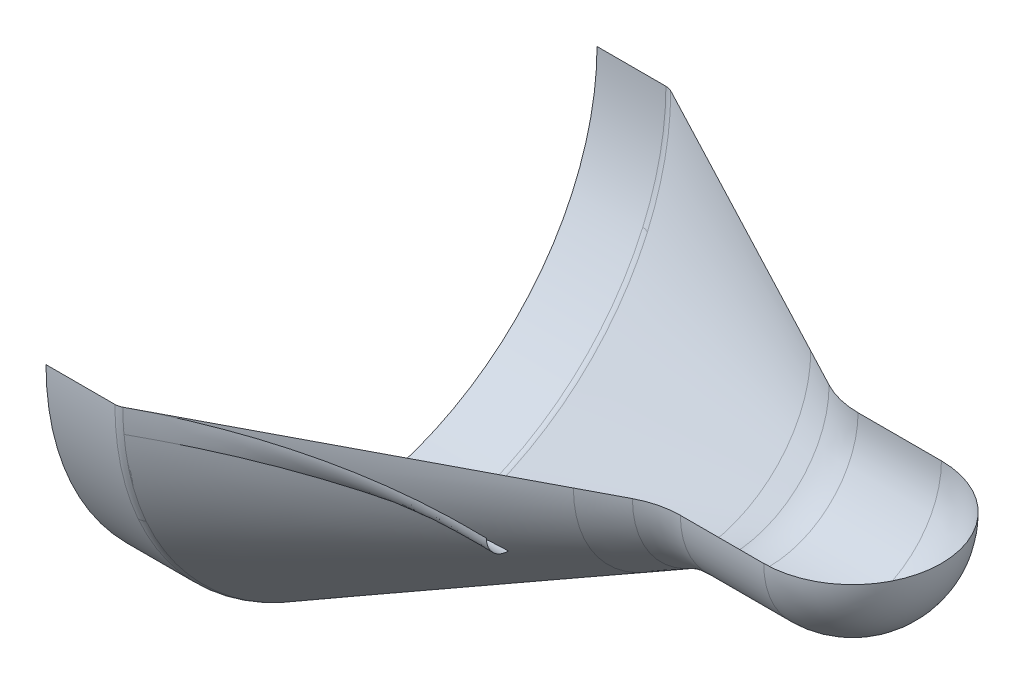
SolidWorks part; units mm, degrees
ref_plane "Vorne" through (0, 0, 0) normal (0, 0, 1) x (1, 0, 0)
ref_plane "Oben" through (0, 0, 0) normal (0, 1, 0) x (1, 0, 0)
ref_plane "Rechts" through (0, 0, 0) normal (1, 0, 0) x (0, 0, -1)
sketch "Skizze1" plane through (0, 0, 0) normal (0, 1, 0) x (1, 0, 0)
  line L0 (0, 0) -> (770.7263, 0) construction
  line L1 (0, 200) -> (50, 200)
  line L2 (54.6536, 198.8512) -> (297.0781, 71.3929)
  line L3 (2, 198) -> (50, 198) construction
  line L4 (0, 198) -> (50, 198) construction
  line L5 (385.5, 64.5) -> (325, 64.5)
  line L6 (53.7229, 197.081) -> (296.1474, 69.6226) construction
  line L7 (385.5, 62.5) -> (325, 62.5) construction
  line L8 (0, 200) -> (0, 198) construction
  line L9 (448, 0) -> (450, 0) construction
  line L10 (385.5, 64.5) -> (385.5, 62.5) construction
  line L12 (0, 200) -> (0, 196.253) construction
  line L19 (2, 198) -> (2, 196.253) construction
  arc A0 (50, 200) -> (54.6536, 198.8512) centre (50, 190) cw
  arc A1 (50, 198) -> (53.7229, 197.081) centre (50, 190) cw construction
  arc A2 (325, 62.5) -> (296.1474, 69.6226) centre (325, 124.5) cw construction
  arc A3 (385.5, 62.5) -> (448, 0) centre (385.5, 0) cw construction
  arc A4 (325, 64.5) -> (297.0781, 71.3929) centre (325, 124.5) cw
  arc A8 (385.5, 64.5) -> (450, 0) centre (385.5, 0) cw
  point P14 (87.3818, 188.4588)
  point P15 (510.3654, -55.7509)
  dimension "D2" = 10
  dimension "D4" = 2
  dimension "D5" = 60
  dimension "D7" = 64.5
  dimension "D3" = 400
  dimension "D6" = 50
  dimension "D8" = 325
  dimension "D13" = 450
surface "Oberfläche-Rotation1" sketch "Skizze1" parameters "D1"=180
ref_plane "Ebene1" through (100, 0, 0) normal (1, 0, 0) x (0, 0, -1)
sketch "Skizze9" plane through (0, 0, 0) normal (0, 0, 1) x (1, 0, 0)
  line L0 (50, -80.3054) -> (54.6536, -80.3054)
  line L1 (50, -200) -> (50, 0) construction
  line L2 (54.6536, -198.8512) -> (54.6536, 0) construction
ref_plane "Ebene2" through (269, 0, 0) normal (1, 0, 0) x (0, 0, -1)
sketch "Skizze11" plane through (269, 0, 0) normal (1, 0, 0) x (0, 0, -1)
  line L0 (-49.3016, -16) -> (-133.3016, -16) construction
  line L2 (-49.3016, -16) -> (-133.3016, -16)
  arc A0 (-149.3016, 0) -> (-133.3016, -16) centre (-133.3016, 0) ccw construction
  arc A2 (-149.3016, 0) -> (-133.3016, -16) centre (-133.3016, 0) ccw
surface "Oberfläche-Ausformung2"
surface "Oberfläche-Trimmen2"
sketch "Skizze13" plane through (0, 0, 0) normal (0, 0, 1) x (1, 0, 0)
  line L0 (269, 0) -> (269, -141.9302)
other "Fläche löschen1"
